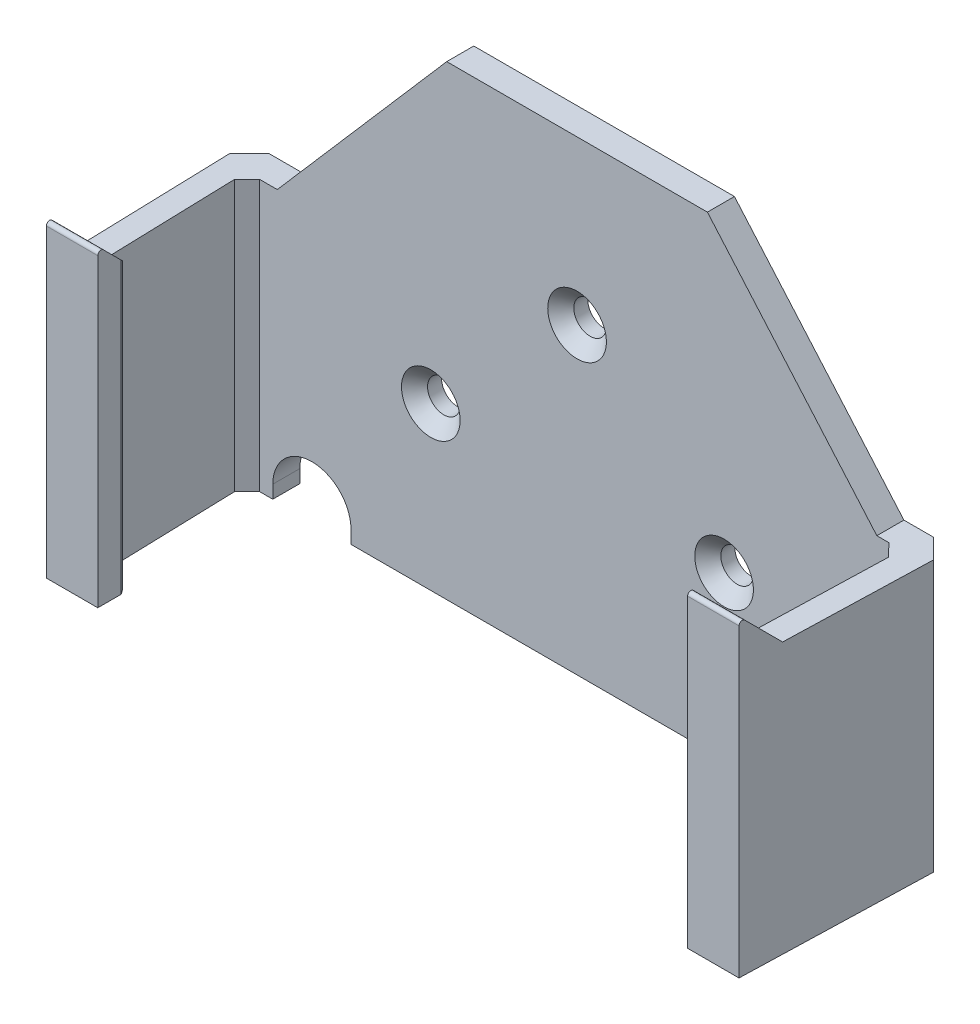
SolidWorks part; units mm, degrees
ref_plane "Ön Düzlem" through (0, 0, 0) normal (0, 0, 1) x (1, 0, 0)
ref_plane "Üst Düzlem" through (0, 0, 0) normal (0, 1, 0) x (1, 0, 0)
ref_plane "Sağ Düzlem" through (0, 0, 0) normal (1, 0, 0) x (0, 0, -1)
sketch "Çizim1" plane through (0, 0, 0) normal (0, 0, 1) x (1, 0, 0)
  line L1 (0, 0) -> (108, 0)
  line L2 (0, 0) -> (0, 48)
  line L4 (108, 0) -> (108, 48)
  line L6 (54, 74) -> (54, 0) construction
  line L9 (0, 48) -> (108, 48)
  dimension "D1" = 108
  dimension "D2" = 48
extrude "Yükseklik-Ekstrüzyon1" add sketch "Çizim1" along normal blind 32
sketch "Çizim2" plane through (0, 48, 0) normal (0, 1, 0) x (1, 0, 0)
  line L0 (8.75, -32) -> (99.25, -32)
  line L1 (3.75, -4.1499) -> (4.45, -27.6999)
  line L2 (8.75, -32) -> (8.75, -28.4256)
  line L3 (8.25, -27.6999) -> (4.45, -27.6999)
  line L6 (54, 0) -> (54, -32) construction
  line L7 (108, 0) -> (0, 0) construction
  line L8 (108, -32) -> (0, -32) construction
  line L10 (8.25, -27.6999) -> (8.75, -28.4256)
  line L11 (104.25, -4.1499) -> (3.75, -4.1499)
  line L14 (99.25, -32) -> (99.25, -28.4256)
  line L15 (99.75, -27.6999) -> (99.25, -28.4256)
  line L16 (99.75, -27.6999) -> (103.55, -27.6999)
  line L17 (104.25, -4.1499) -> (103.55, -27.6999)
  point P15 (54, -4.1499)
  point P19 (54, -4.1499)
  dimension "D1" = 50.25
  dimension "D2" = 49.55
  dimension "D3" = 23.55
  dimension "D4" = 4.3
  dimension "D5" = 0.5
extrude "Kes-Ekstrüzyon1" cut sketch "Çizim2" against normal blind 119 contours L15 L14 L0 L2 L10 L3 L1 L11 L17 L16
chamfer "Pah1" distance 3 angle 45 2 edges at (108, 24, 0) (0, 24, 0)
sketch "Çizim4" plane through (0, 0, 0) normal (-1, 0, 0) x (0, 0, 1)
  line L0 (32, 48) -> (25.5, 41.5)
  line L1 (25.5, 41.5) -> (0, 41.5)
  line L2 (0, 0) -> (0, 48) construction
  line L3 (0, 41.5) -> (0, 48)
  line L4 (0, 48) -> (32, 48)
  dimension "D1" = 6.5
  dimension "D2" = 6.5
extrude "Kes-Ekstrüzyon2" cut sketch "Çizim4" against normal blind 116
fillet "Radyus2" radius 0.5 2 edges at (103.625, 48, 32) (4.375, 48, 32)
sketch "Çizim6" plane through (0, 41.5, 0) normal (0, 1, 0) x (1, 0, 0)
  line L0 (0, -3) -> (0.862, -32)
  line L1 (8.75, -32) -> (0, -32) construction
  line L2 (0.862, -32) -> (-3.7056, -32)
  line L3 (-3.7056, -32) -> (0, -3)
  line L4 (3.75, -4.1499) -> (4.3846, -25.5) construction
  line L5 (54, 0) -> (54, -36) construction
  line L6 (105, 0) -> (3, 0) construction
  line L7 (111.7056, -32) -> (108, -3)
  line L8 (107.138, -32) -> (111.7056, -32)
  line L9 (108, -3) -> (107.138, -32)
extrude "Kes-Ekstrüzyon4" cut sketch "Çizim6" against normal mid plane 100
sketch "Çizim7" plane through (0, 0, 0) normal (0, 0, -1) x (-1, 0, 0)
  line L0 (-94.75, 8) -> (-83.0882, 8) construction
  line L1 (-3, 0) -> (-105, 0) construction
  line L2 (-88.75, 2) -> (-88.75, -3.4773) construction
  line L3 (-94.75, 2) -> (-13.75, 2) construction
  line L6 (-100.75, 2) -> (-100.75, 0)
  line L7 (-88.75, 2) -> (-88.75, 0)
  line L8 (-88.75, 0) -> (-100.75, 0)
  line L9 (-104.25, 41.5) -> (-104.25, 0) construction
  line L10 (-19.75, 2) -> (-19.75, 0)
  line L11 (-19.75, 0) -> (-7.75, 0)
  line L12 (-7.75, 2) -> (-7.75, 0)
  line L16 (-4.45, 43.6999) -> (-4.45, 0) construction
  line L19 (-105, 41.5) -> (-3, 41.5) construction
  line L20 (-108, 0) -> (-108, 41.5) construction
  arc A0 (-88.75, 2) -> (-100.75, 2) centre (-94.75, 2) ccw
  arc A1 (-19.75, 2) -> (-7.75, 2) centre (-13.75, 2) cw
  dimension "D1" = 12
  dimension "D2" = 3.75
  dimension "D3" = 8
  dimension "D4" = 93
  dimension "D5" = 3.5
extrude "Kes-Ekstrüzyon5" cut sketch "Çizim7" against normal blind 4.25
sketch "Çizim8" plane through (0, 0, 0) normal (0, 0, -1) x (-1, 0, 0)
  line L0 (-105, 41.5) -> (-105, 0) construction
  circle A0 centre (-77, 24.8351) radius 2.5
  circle A1 centre (-32, 24.8351) radius 2.5
  dimension "D1" = 5
  dimension "D2" = 5
  dimension "D3" = 45
  dimension "D4" = 28
extrude "Kes-Ekstrüzyon6" cut sketch "Çizim8" against normal blind 10
chamfer "Pah2" distance 2 angle 45 2 edges at (74.5, 24.8351, 4.1499) (29.5, 24.8351, 4.1499)
fillet "Radyus4" radius 0.2 2 edges at (103.55, 21.8499, 27.6999) (4.45, 21.8499, 27.6999)
chamfer "Pah3" distance 2 angle 45 2 edges at (104.25, 20.75, 4.1499) (3.75, 20.75, 4.1499)
sketch "Çizim10" plane through (0, 0, 0) normal (0, 0, -1) x (-1, 0, 0)
  line L0 (-100.4406, 41.5) -> (-74.4406, 71.5)
  line L1 (-105, 41.5) -> (-3, 41.5) construction
  line L2 (-74.4406, 71.5) -> (-34.4406, 71.5)
  line L3 (-34.4406, 71.5) -> (-8.4406, 41.5)
  line L4 (-8.4406, 41.5) -> (-100.4406, 41.5)
  line L5 (-54.4406, 41.5) -> (-54.4406, 80.707) construction
  point P9 (-54.4406, 71.5)
  dimension "D1" = 92
  dimension "D2" = 3.75
  dimension "D3" = 40
  dimension "D4" = 30
extrude "Yükseklik-Ekstrüzyon3" add sketch "Çizim10" against normal up to surface (4.1499 mm away)
sketch "Çizim11" plane through (0, 0, 4.1499) normal (0, 0, 1) x (1, 0, 0)
  line L0 (54.4406, 71.5) -> (54.4406, 46.5) construction
  line L1 (74.4406, 71.5) -> (34.4406, 71.5) construction
  circle A0 centre (54.4406, 46.5) radius 2.5
  dimension "D1" = 5
  dimension "D2" = 25
extrude "Kes-Ekstrüzyon7" cut sketch "Çizim11" against normal blind 9
chamfer "Pah4" distance 2 angle 45 1 edges at (56.9406, 46.5, 4.1499)
